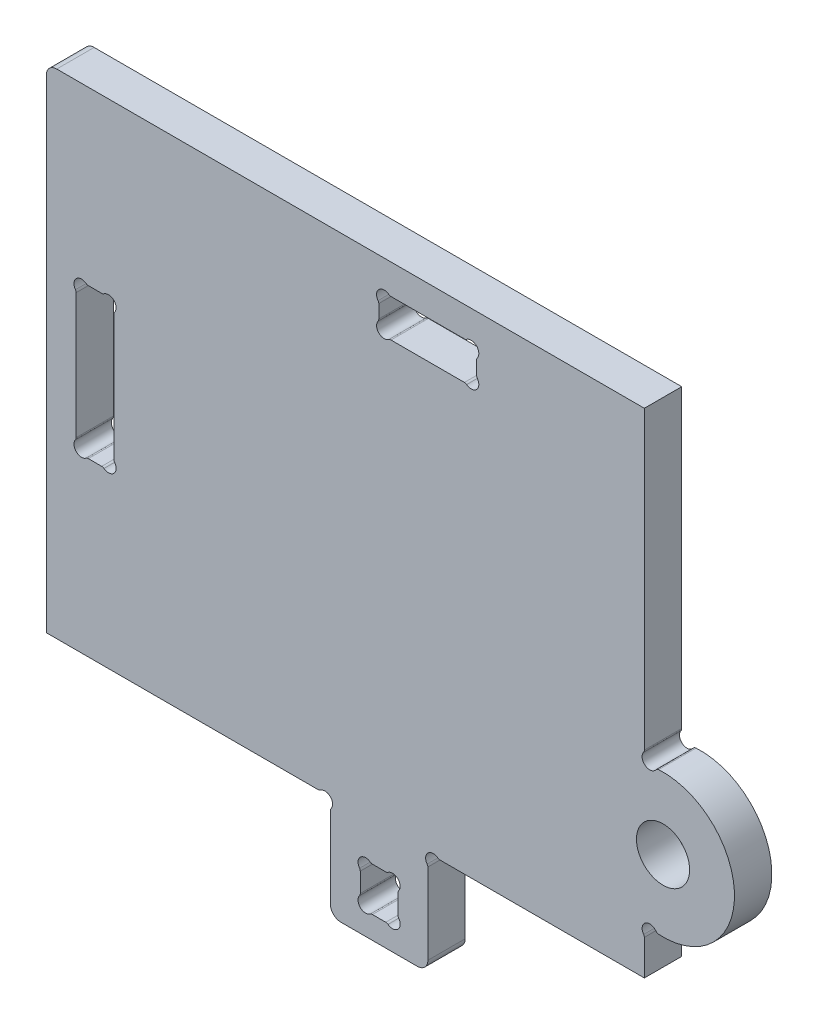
SolidWorks part; units mm, degrees
ref_plane "Plan de face" through (0, 0, 0) normal (0, 0, 1) x (1, 0, 0)
ref_plane "Plan de dessus" through (0, 0, 0) normal (0, 1, 0) x (1, 0, 0)
ref_plane "Plan de droite" through (0, 0, 0) normal (1, 0, 0) x (0, 0, -1)
sketch "Esquisse2" plane through (0, 0, 0) normal (0, 0, 1) x (1, 0, 0)
  line L0 (0, 69.1667) -> (-3.6062, 65.5604) construction
  line L1 (0, 0) -> (65.2, 0)
  line L2 (0, 0) -> (0, 61.0356)
  line L3 (-190, 399.1667) -> (210, 399.1667)
  line L4 (73.331, 69.1667) -> (210, 69.1667)
  line L5 (210, 399.1667) -> (210, 201.1889)
  line L6 (65.2, 69.1667) -> (68.8062, 65.5604) construction
  line L7 (-8.131, 69.1667) -> (-190, 69.1667)
  line L8 (210, 159.4443) -> (209.9293, 159.515) construction
  line L9 (32.6, 29.5833) -> (32.6, 44.1667) construction
  line L10 (20, 23.131) -> (20, 36.0356)
  line L11 (65.2, 0) -> (65.2, 61.0356)
  line L12 (37.069, 15) -> (28.131, 15)
  line L13 (-190, 69.1667) -> (-190, 399.1667)
  line L14 (45.2, 29.5833) -> (20, 29.5833) construction
  line L15 (45.2, 23.131) -> (45.2, 36.0356)
  line L16 (37.069, 44.1667) -> (28.131, 44.1667)
  line L17 (45.2, 44.1667) -> (41.5938, 40.5604) construction
  line L18 (222.5, 146.9443) -> (222.5, 194.722) construction
  line L19 (222.5, 129.1667) -> (195.0371, 129.1667) construction
  line L20 (270.2777, 146.9443) -> (222.5, 146.9443) construction
  line L21 (210, 92.6998) -> (210, 69.1667)
  line L32 (210, 159.4443) -> (235, 134.4443) construction
  line L34 (210, 159.4443) -> (235, 159.4443) construction
  line L35 (235, 159.4443) -> (235, 134.4443) construction
  line L36 (210, 193.0578) -> (213.6062, 196.6641) construction
  arc A0 (0.4914, 62.524) -> (-6.6426, 69.658) centre (-3.6062, 65.5604) ccw
  arc A1 (0, 61.0356) -> (0.4914, 62.524) centre (2.5, 61.0356) cw
  arc A2 (-6.6426, 69.658) -> (-8.131, 69.1667) centre (-8.131, 71.6667) cw
  arc A3 (71.8426, 69.658) -> (64.7086, 62.524) centre (68.8062, 65.5604) ccw
  arc A4 (71.8426, 69.658) -> (73.331, 69.1667) centre (73.331, 71.6667) ccw
  arc A5 (64.7086, 62.524) -> (65.2, 61.0356) centre (62.7, 61.0356) cw
  arc A6 (45.6914, 37.524) -> (38.5574, 44.658) centre (41.5938, 40.5604) ccw
  arc A7 (45.6914, 37.524) -> (45.2, 36.0356) centre (47.7, 36.0356) ccw
  arc A8 (38.5574, 44.658) -> (37.069, 44.1667) centre (37.069, 46.6667) cw
  arc A9 (26.6426, 44.658) -> (28.131, 44.1667) centre (28.131, 46.6667) ccw
  arc A10 (19.5086, 37.524) -> (26.6426, 44.658) centre (23.6062, 40.5604) cw
  arc A11 (19.5086, 37.524) -> (20, 36.0356) centre (17.5, 36.0356) cw
  arc A12 (19.5086, 21.6426) -> (20, 23.131) centre (17.5, 23.131) ccw
  arc A13 (19.5086, 21.6426) -> (26.6426, 14.5086) centre (23.6062, 18.6062) ccw
  arc A14 (26.6426, 14.5086) -> (28.131, 15) centre (28.131, 12.5) cw
  arc A15 (38.5574, 14.5086) -> (37.069, 15) centre (37.069, 12.5) ccw
  arc A16 (45.6914, 21.6426) -> (38.5574, 14.5086) centre (41.5938, 18.6062) cw
  arc A17 (45.6914, 21.6426) -> (45.2, 23.131) centre (47.7, 23.131) cw
  arc A18 (209.5086, 94.1882) -> (210, 92.6998) centre (207.5, 92.6998) cw
  arc A19 (209.5086, 94.1882) -> (217.7022, 100.2632) centre (213.6062, 97.2246) cw
  arc A20 (217.7022, 100.2632) -> (219.556, 99.2575) centre (219.71, 101.7527) ccw
  arc A42 (219.556, 99.2575) -> (219.556, 194.6312) centre (222.5, 146.9443) ccw
  circle A43 centre (222.5, 146.9443) radius 17.7777
  arc A44 (209.5086, 199.7005) -> (217.7022, 193.6255) centre (213.6062, 196.6641) ccw
  arc A45 (217.7022, 193.6255) -> (219.556, 194.6312) centre (219.71, 192.136) cw
  arc A46 (209.5086, 199.7005) -> (210, 201.1889) centre (207.5, 201.1889) ccw
  point P1 (222.5, 146.9443)
  point P44 (32.6, 44.1667)
  point P61 (32.6, 0)
extrude "Boss.-Extru.2" add sketch "Esquisse2" along normal blind 25
fillet "Congé1" radius 7 3 edges at (0, 0, 12.5) (65.2, 0, 12.5) (-190, 399.1667, 12.5)
sketch "Sketch4" plane through (0, 0, 25) normal (0, 0, 1) x (1, 0, 0)
  line L0 (-157.4, 196.6667) -> (-157.4, 184.0667) construction
  line L1 (-190, 392.1667) -> (-190, 69.1667) construction
  line L2 (210, 399.1667) -> (-183, 399.1667) construction
  line L3 (7, 0) -> (58.2, 0) construction
  line L4 (-144.9, 184.0667) -> (-144.9, 284.2667) construction
  line L5 (-144.8, 276.1356) -> (-144.8, 192.1977)
  line L6 (-161.869, 284.2667) -> (-152.931, 284.2667)
  line L7 (-170, 234.1667) -> (-144.8, 234.1667) construction
  line L8 (-170, 276.1356) -> (-170, 192.1977)
  line L9 (-161.869, 184.0667) -> (-152.931, 184.0667)
  line L10 (-170, 184.0667) -> (-157.4, 196.6667) construction
  line L11 (-157.4, 399.1667) -> (-157.4, 69.1667) construction
  line L12 (-190, 69.1667) -> (-8.131, 69.1667) construction
  line L13 (45, 366.5667) -> (32.4, 366.5667) construction
  line L14 (89.669, 353.9667) -> (40.531, 353.9667)
  line L15 (97.8, 371.0356) -> (97.8, 362.0977)
  line L16 (65.1, 379.1667) -> (65.1, 353.9667) construction
  line L17 (89.669, 379.1667) -> (40.531, 379.1667)
  line L18 (32.4, 371.0356) -> (32.4, 362.0977)
  line L19 (32.4, 379.1667) -> (45, 366.5667) construction
  arc A0 (-170.4914, 190.7093) -> (-163.3574, 183.5753) centre (-166.3938, 187.6729) ccw
  arc A1 (-170.4914, 190.7093) -> (-170, 192.1977) centre (-172.5, 192.1977) ccw
  arc A2 (-163.3574, 183.5753) -> (-161.869, 184.0667) centre (-161.869, 181.5667) cw
  arc A3 (-151.4426, 183.5753) -> (-152.931, 184.0667) centre (-152.931, 181.5667) ccw
  arc A4 (-144.3086, 190.7093) -> (-151.4426, 183.5753) centre (-148.4062, 187.6729) cw
  arc A5 (-144.3086, 190.7093) -> (-144.8, 192.1977) centre (-142.3, 192.1977) cw
  arc A6 (-144.3086, 277.624) -> (-144.8, 276.1356) centre (-142.3, 276.1356) ccw
  arc A7 (-144.3086, 277.624) -> (-151.4426, 284.758) centre (-148.4062, 280.6604) ccw
  arc A8 (-151.4426, 284.758) -> (-152.931, 284.2667) centre (-152.931, 286.7667) cw
  arc A9 (-163.3574, 284.758) -> (-161.869, 284.2667) centre (-161.869, 286.7667) ccw
  arc A10 (-170.4914, 277.624) -> (-163.3574, 284.758) centre (-166.3938, 280.6604) cw
  arc A11 (-170.4914, 277.624) -> (-170, 276.1356) centre (-172.5, 276.1356) cw
  arc A12 (39.0426, 379.658) -> (31.9086, 372.524) centre (36.0062, 375.5604) ccw
  arc A13 (39.0426, 379.658) -> (40.531, 379.1667) centre (40.531, 381.6667) ccw
  arc A14 (31.9086, 372.524) -> (32.4, 371.0356) centre (29.9, 371.0356) cw
  arc A15 (31.9086, 360.6093) -> (32.4, 362.0977) centre (29.9, 362.0977) ccw
  arc A16 (39.0426, 353.4753) -> (31.9086, 360.6093) centre (36.0062, 357.5729) cw
  arc A17 (39.0426, 353.4753) -> (40.531, 353.9667) centre (40.531, 351.4667) cw
  arc A18 (91.1574, 353.4753) -> (89.669, 353.9667) centre (89.669, 351.4667) ccw
  arc A19 (91.1574, 353.4753) -> (98.2914, 360.6093) centre (94.1938, 357.5729) ccw
  arc A20 (98.2914, 360.6093) -> (97.8, 362.0977) centre (100.3, 362.0977) cw
  arc A21 (98.2914, 372.524) -> (97.8, 371.0356) centre (100.3, 371.0356) ccw
  arc A22 (91.1574, 379.658) -> (98.2914, 372.524) centre (94.1938, 375.5604) cw
  arc A23 (91.1574, 379.658) -> (89.669, 379.1667) centre (89.669, 381.6667) cw
  point P0 (-157.4, 234.1667)
  point P1 (32.6, 0)
  point P27 (-157.4, 184.0667)
  point P48 (-157.4, 234.1667)
  point P65 (32.4, 366.5667)
extrude "Cut-Extrude2" cut sketch "Sketch4" against normal through all
equation "\"D1@Boss.-Extru.2\" = \"material_thickness\""
equation "\"tool_diameter\"=10"
equation "\"hole_clearance\"=0.1"
equation "\"material_thickness\"=25"
equation "\"clearance\"=0.1"
equation "\"outer_slot\"=0.5"
equation "\"fillet\"=7"
equation "\"D7@Esquisse2\"=\"material_thickness\"/10"
equation "\"string\"= 2 * \"tool_diameter\" / 2 * cos ( 45deg )"
equation "\"angle\"= IIF ( \"string\" < \"limit\" , 45 , ( 180 - 2 * arcsin ( \"ThicknessVStool_dia\" ) ) / 2 )"
equation "\"limit\"= \"material_thickness\" / 2 * 5 / 6"
equation "\"ThicknessVStool_dia\"= IIF ( \"limit\" / \"tool_diameter\" > 1 , 1 , \"limit\" / \"tool_diameter\" )"
equation "\"D1@Congé1\"= \"fillet\""
equation "\"D23@Esquisse2\"=\"material_thickness\""
equation "\"D27@Esquisse2\"= \"material_thickness\" / 2"
equation "\"D29@Esquisse2\"=\"material_thickness\"/10"
equation "\"D5@Sketch4\"=\"tool_diameter\" / 2 + \"hole_clearance\""
equation "\"D4@Sketch4\" = \"material_thickness\" / 2 + \"clearance\""
equation "\"D6@Sketch4\"=\"material_thickness\"/10"
equation "\"D1@Sketch4\"=\"angle\""
equation "\"D10@Sketch4\"=\"tool_diameter\" / 2 + \"hole_clearance\""
equation "\"D9@Sketch4\" = \"material_thickness\" / 2 + \"clearance\""
equation "\"D11@Sketch4\"=\"material_thickness\"/10"
equation "\"D8@Sketch4\"=\"angle\""
equation "\"D9@Esquisse2\"=\"hole_clearance\""
equation "\"D11@Esquisse2\"=\"material_thickness\"/2*7/6"
equation "\"D12@Esquisse2\"=\"material_thickness\"/2 +\"clearance\""
equation "\"D13@Esquisse2\"=\"tool_diameter\"/2 + \"hole_clearance\""
equation "\"D5@Esquisse2\"=\"angle\""
equation "\"D14@Esquisse2\"=\"material_thickness\"/10"
equation "\"D2@Sketch4\"=50 + \"clearance\""
equation "\"D20@Esquisse2\"=\"material_thickness\""
equation "\"D13@Sketch4\"=40 +\"material_thickness\" + \"clearance\"*2 + \"clearance\"*2"
equation "\"D12@Sketch4\"=\"clearance\""
equation "\"D4@Esquisse2\"=\"tool_diameter\"/2 +\"hole_clearance\""
